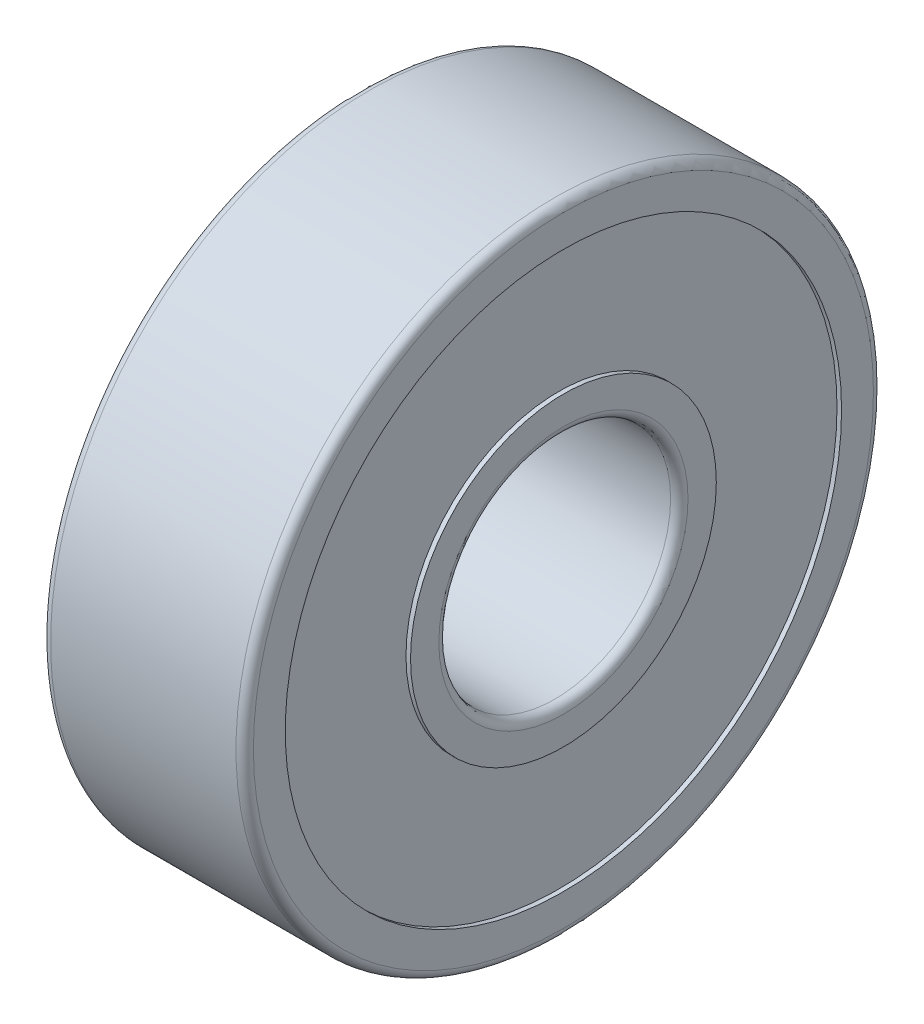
SolidWorks part; units mm, degrees
ref_plane "Front Plane" through (0, 0, 0) normal (0, 0, 1) x (1, 0, 0)
ref_plane "Top Plane" through (0, 0, 0) normal (0, 1, 0) x (1, 0, 0)
ref_plane "Right Plane" through (0, 0, 0) normal (1, 0, 0) x (0, 0, -1)
sketch "Sketch1" plane through (0, 0, 0) normal (0, 0, 1) x (1, 0, 0)
  line L0 (0, 0) -> (-7, 0) construction
  line L1 (-3.5, 0) -> (-3.5, 6.05) construction
  line L2 (-3.5, 0) -> (-3.5, 4) construction
  line L3 (-6.7, 4) -> (-0.3, 4)
  line L4 (0, 4.3) -> (0, 5.2771)
  line L5 (-0.61, 6.0271) -> (-2, 6.0271)
  line L6 (-3.5, 0) -> (-3.5, 7.35) construction
  line L7 (-6.69, 5.2771) -> (-7, 5.2771)
  line L8 (-0.61, 6.0271) -> (-0.61, 5.5771)
  line L9 (-0.31, 5.2771) -> (0, 5.2771)
  line L10 (-6.39, 6.0271) -> (-5, 6.0271)
  line L11 (-6.39, 6.0271) -> (-6.39, 5.5771)
  line L12 (-7, 4.3) -> (-7, 5.2771)
  line L13 (-3.5, 0) -> (-3.5, 11) construction
  line L14 (-0.3, 11) -> (-6.7, 11)
  line L15 (-7, 10.7) -> (-7, 9.6)
  line L16 (-7, 9.6) -> (-6.843, 9.6)
  line L17 (-6.843, 9.6) -> (-6.4426, 9.6) construction
  line L18 (-6.4426, 9.6) -> (-6.3024, 8.8048)
  line L19 (-0.6976, 8.8048) -> (-2.1276, 8.8048)
  line L20 (-0.5574, 9.6) -> (-0.6976, 8.8048)
  line L21 (-6.3024, 8.8048) -> (-4.8724, 8.8048)
  line L22 (0, 9.6) -> (-0.157, 9.6)
  line L23 (0, 10.7) -> (0, 9.6)
  line L28 (-3.5, 7.35) -> (-0.6956, 7.35) construction
  line L30 (-0.61, 6.0271) -> (-0.608, 6.0271) construction
  line L32 (-0.61, 5.5771) -> (-0.608, 5.5771) construction
  line L35 (-0.6956, 8.8048) -> (-0.2992, 8.8048) construction
  arc A0 (-2, 6.0271) -> (-5, 6.0271) centre (-3.5, 7.35) cw
  arc A1 (-0.61, 5.5771) -> (-0.31, 5.2771) centre (-0.31, 5.5771) ccw
  arc A2 (-0.3, 4) -> (0, 4.3) centre (-0.3, 4.3) ccw
  arc A3 (-6.7, 4) -> (-7, 4.3) centre (-6.7, 4.3) cw
  arc A4 (-6.39, 5.5771) -> (-6.69, 5.2771) centre (-6.69, 5.5771) cw
  circle A5 centre (-3.5, 7.35) radius 2 construction
  arc A6 (-6.843, 9.6) -> (-6.4426, 9.6) centre (-6.6428, 9.6) cw
  arc A7 (-6.7, 11) -> (-7, 10.7) centre (-6.7, 10.7) ccw
  arc A8 (-0.157, 9.6) -> (-0.5574, 9.6) centre (-0.3572, 9.6) ccw
  arc A9 (-0.3, 11) -> (0, 10.7) centre (-0.3, 10.7) cw
  arc A10 (-4.8724, 8.8048) -> (-2.1276, 8.8048) centre (-3.5, 7.35) cw
  point P16 (-0.61, 5.2771)
  point P36 (-7, 11)
  dimension "D8" = 1.39
  dimension "D5" = 0.3
  dimension "D6" = 0.3
  dimension "D10" = 2
  dimension "D13" = 5.2771
  dimension "D18" = 100
  dimension "D19" = 0.3
  dimension "D25" = 0.002
  dimension "D1" = 7
  dimension "D2" = 6.05
  dimension "D3" = 4
  dimension "D4" = 7
  dimension "D7" = 7.35
  dimension "D9" = 0.75
  dimension "D12" = 2.0271
  dimension "D14" = 2
  dimension "D15" = 11
  dimension "D16" = 1.4
  dimension "D17" = 0.157
  dimension "D21" = 0.4004
  dimension "D22" = 1.43
  dimension "D26" = 0.002
  dimension "D28" = 0.3964
revolve "Revolve1" add sketch "Sketch1" angle 360 about L0
sketch "Sketch2" plane through (0, 0, 0) normal (0, 1, 0) x (1, 0, 0)
  line L0 (-5.4845, 7.35) -> (-1.5155, 7.35)
  line L2 (-3.5, 9.35) -> (-3.5, 5.35) construction
  line L3 (-4.8724, 7.35) -> (-2.1276, 7.35) construction
  line L4 (-4.8724, 8.8048) -> (-4.8724, -8.8048) construction
  line L5 (-2.1276, 8.8048) -> (-2.1276, -8.8048) construction
  arc A0 (-2.1276, 8.8048) -> (-4.8724, 8.8048) centre (-3.5, 7.35) ccw construction
  arc A1 (-5, 6.0271) -> (-2, 6.0271) centre (-3.5, 7.35) ccw construction
  arc A2 (-5.4845, 7.35) -> (-1.5155, 7.35) centre (-3.5, 7.35) cw
  point P3 (-3.5, 7.35)
  dimension "D1" = 3.969
revolve "Revolve2" add sketch "Sketch2" angle 360 about L3
pattern_circular "CirPattern6" count 7 over 360 about axis through (0, 0, 0) along (1, 0, 0)
sketch "Sketch3" plane through (0, 0, 0) normal (0, 0, 1) x (1, 0, 0)
  line L0 (-0.5574, 9.6) -> (-0.6976, 8.8048) construction
  line L1 (-0.5574, 9.6) -> (-0.6976, 8.8048)
  line L2 (-0.61, 5.5771) -> (-0.61, 6.0271)
  line L3 (-0.61, 6.0271) -> (-0.6976, 8.8048)
  line L4 (-0.157, 9.6) -> (-0.157, 5.2771)
  line L5 (-0.157, 9.6) -> (-0.157, -9.6) construction
  line L6 (-0.157, 5.2771) -> (-0.31, 5.2771)
  arc A0 (-0.157, 9.6) -> (-0.5574, 9.6) centre (-0.3572, 9.6) ccw construction
  arc A1 (-0.61, 5.5771) -> (-0.31, 5.2771) centre (-0.31, 5.5771) ccw construction
  arc A2 (-0.157, 9.6) -> (-0.5574, 9.6) centre (-0.3572, 9.6) ccw
  arc A3 (-0.61, 5.5771) -> (-0.31, 5.2771) centre (-0.31, 5.5771) ccw
revolve "Revolve3" add sketch "Sketch3" angle 360
sketch "Sketch4" plane through (-7, 0, 0) normal (-1, 0, 0) x (0, 0, 1)
  line L0 (0, 0) -> (-0.0597, 6.8447) construction
  arc A0 (4.0209, 8.9371) -> (-4.1763, 8.8656) centre (0, 0) ccw construction
  text T0 "SKF 608 - 2RSH/C3" font "Century Gothic" height 0.65
extrude "Cut-Extrude2" cut sketch "Sketch4" against normal blind 0.02
